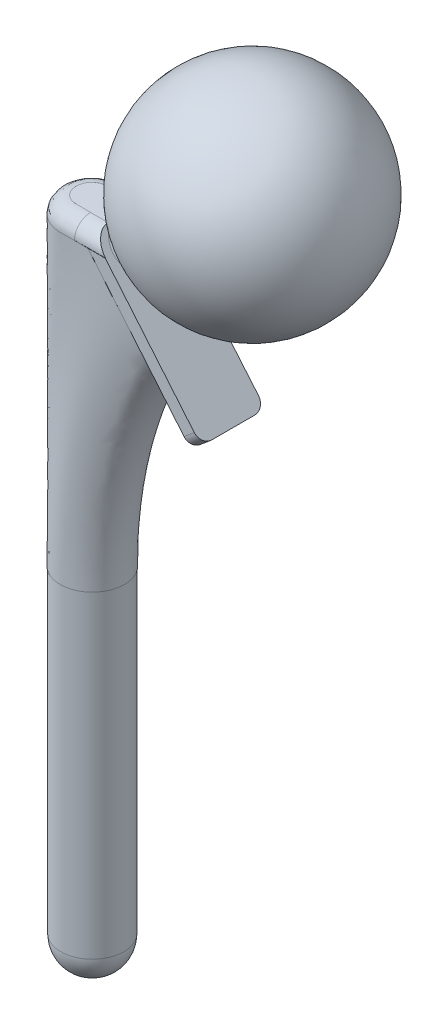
SolidWorks part; units mm, degrees
ref_plane "Front Plane" through (0, 0, 0) normal (0, 0, 1) x (1, 0, 0)
ref_plane "Top Plane" through (0, 0, 0) normal (0, 1, 0) x (1, 0, 0)
ref_plane "Right Plane" through (0, 0, 0) normal (1, 0, 0) x (0, 0, -1)
sketch "Sketch1" plane through (0, 0, 0) normal (0, 0, 1) x (1, 0, 0)
  line L0 (0, 0) -> (0, -7.493) construction
  line L1 (7.493, 0) -> (7.493, 75.565)
  line L2 (7.493, 75.565) -> (0, 75.565)
  line L3 (0, 75.565) -> (0, 0) construction
  line L4 (0, -7.493) -> (0, 75.565)
  arc A0 (7.493, 0) -> (0, -7.493) centre (0, 0) cw
  dimension "D1" = 7.493
  dimension "D2" = 75.565
revolve "Revolve1" add sketch "Sketch1" angle 360 about L4
sketch "Sketch2" plane through (0, 75.565, 0) normal (0, 1, 0) x (1, 0, 0)
  circle A0 centre (0, 0) radius 7.62
  dimension "D1" = 15.24
ref_plane "Plane1" through (0, 151.765, 0) normal (0, 1, 0) x (-1, 0, 0)
sketch "Sketch3" plane through (0, 151.765, 0) normal (0, 1, 0) x (-1, 0, 0)
  line L0 (0, 7.62) -> (-31.75, 7.62)
  line L1 (-31.75, -7.62) -> (0, -7.62)
  arc A0 (0, -7.62) -> (0, 7.62) centre (0, 0) ccw
  circle A1 centre (0, 0) radius 7.62 construction
  arc A2 (-31.75, 7.62) -> (-31.75, -7.62) centre (-31.75, 0) ccw
  dimension "D1" = 15.24
  dimension "D2" = 31.75
sketch "Sketch4" plane through (0, 0, 0) normal (0, 0, 1) x (1, 0, 0)
  line L0 (7.62, 75.565) -> (-7.62, 75.565) construction
  line L1 (39.37, 151.765) -> (31.75, 151.765) construction
  line L2 (7.62, 75.565) -> (7.62, 66.6693) construction
  line L3 (0, 0) -> (0, 75.565) construction
  line L4 (0, 75.565) -> (0, 151.765) construction
  line L5 (0, 151.765) -> (-7.62, 151.765) construction
  line L6 (31.75, 151.765) -> (0, 151.765) construction
  arc A0 (7.62, 75.565) -> (39.37, 151.765) centre (114.935, 75.565) cw
  dimension "D1" = 7.62
  dimension "D2" = 39.37
sketch "Sketch5" plane through (0, 0, 0) normal (0, 0, 1) x (1, 0, 0)
  line L0 (-7.62, 75.565) -> (-7.62, 151.765)
  line L1 (7.62, 75.565) -> (-7.62, 75.565) construction
  line L2 (0, 151.765) -> (-7.62, 151.765) construction
  line L3 (0, 75.565) -> (0, 151.765) construction
  dimension "D1" = 7.62
loft "Loft2" add profiles "Sketch2", "Sketch3"
fillet "Fillet1" radius 3.81 4 edges
sketch "Sketch6" plane through (0, 0, 0) normal (0, 0, 1) x (1, 0, 0)
  line L0 (3.3213, 151.765) -> (22.0951, 129.3913)
  line L1 (30.6231, 151.765) -> (-3.81, 151.765) construction
  line L2 (0, 0) -> (0, 151.765) construction
  line L3 (3.3213, 151.765) -> (22.7788, 168.0918)
  line L4 (22.7788, 168.0918) -> (41.5526, 145.7181)
  line L5 (41.5526, 145.7181) -> (22.0951, 129.3913)
  spline S0 degree 3 poles (7.62, 75.565) (7.62, 101.3044) (16.8678, 126.0869) (33.5137, 145.473) knots 0 0 0 0 0.899465 0.899465 0.899465 0.899465 construction
  dimension "D1" = 3.3213
  dimension "D2" = 40
  dimension "D3" = 25.4
extrude "Extrude1" cut sketch "Sketch6" against normal mid plane 50.8
sketch "Sketch7" plane through (76.6787, 64.3411, 0) normal (0.766, 0.6428, 0) x (0, 0, -1)
  line L0 (7.5712, 109.1027) -> (7.6173, 73.546)
  line L1 (5.0773, 71.0027) -> (-5.0773, 71.0027)
  line L2 (-7.6173, 73.546) -> (-7.5712, 109.1027)
  line L3 (-3.7155, 114.1238) -> (3.7155, 114.1238)
  arc A0 (-7.6173, 73.546) -> (-5.0773, 71.0027) centre (-5.0773, 73.5427) ccw
  arc A1 (7.6173, 73.546) -> (5.0773, 71.0027) centre (5.0773, 73.5427) cw
  spline S0 degree 3 poles (7.6207, 57.8862) (7.6207, 58.2373) (7.6207, 58.9145) (7.6207, 59.8857) (7.6207, 60.7784) (7.6207, 61.5932) (7.6207, 62.3316) (7.6207, 62.9945) (7.6207, 63.583) (7.6206, 64.1014) (7.6206, 64.5723) (7.6206, 65.021) (7.6206, 65.4693) (7.6206, 65.9199) (7.6206, 66.3728) (7.6206, 66.828) (7.6206, 67.2854) (7.6206, 68.741) (7.6206, 71.162) (7.6205, 74.4744) (7.6205, 77.6933) (7.6204, 80.8086) (7.6204, 83.7975) (7.6203, 86.8608) (7.6203, 90.0427) (7.6202, 93.1551) (7.6202, 95.9921) (7.6202, 98.1251) (7.6201, 99.7733) (7.6201, 100.588) (7.6201, 100.9912) knots 0 0 0 0 0.020395 0.039344 0.056848 0.072911 0.087536 0.100724 0.112477 0.122799 0.13189 0.140881 0.149946 0.159086 0.168301 0.17759 0.186953 0.196391 0.26726 0.338129 0.408481 0.478834 0.548597 0.616333 0.698332 0.784595 0.857003 0.927193 0.963965 1 1 1 1 construction
  spline S1 degree 3 poles (-7.6201, 100.9912) (-7.6201, 100.7894) (-7.6201, 100.3875) (-7.6201, 99.7732) (-7.6201, 99.1472) (-7.6202, 97.9089) (-7.6202, 95.9919) (-7.6202, 93.1551) (-7.6203, 90.0427) (-7.6203, 86.8608) (-7.6204, 83.7975) (-7.6204, 80.8086) (-7.6205, 77.6933) (-7.6205, 74.4744) (-7.6206, 71.162) (-7.6206, 68.4918) (-7.6206, 66.5332) (-7.6206, 65.3256) (-7.6206, 64.0141) (-7.6207, 62.4164) (-7.6207, 60.346) (-7.6207, 58.7648) (-7.6207, 57.8862) knots 0 0 0 0 0.0181 0.036035 0.054271 0.072808 0.142998 0.215405 0.301668 0.383667 0.451404 0.521167 0.59152 0.661872 0.732741 0.80361 0.828612 0.853085 0.877202 0.90791 0.948827 1 1 1 1 construction
  spline S2 degree 3 poles (1999.5763, 235.4194) (-812.7878, -134.5565) (23.5956, 53.3136) (7.2551, 111.1066) (7.155, 111.3826) (6.9154, 111.9107) (6.7755, 112.1646) (6.4493, 112.6493) (6.2635, 112.878) (5.9555, 113.1861) (5.8476, 113.2835) (5.6201, 113.4665) (5.4997, 113.5526) (5.1277, 113.7852) (4.8642, 113.9083) (-15.2716, 120.0198) (-75.7177, -77.6137) (842.9139, -1696.8115) knots -25.331774 -25.331774 -25.331774 -25.331774 0.25 0.25 0.375 0.375 0.5 0.5 0.625 0.625 0.6875 0.6875 0.75 0.75 0.875 0.875 9.68281 9.68281 9.68281 9.68281 only from (7.5712, 109.1027) to (3.7155, 114.1238) construction
  spline S3 degree 3 poles (7.5712, 109.1027) (7.571, 109.689) (7.4935, 110.2635) (7.2551, 111.1066) (7.155, 111.3826) (6.9154, 111.9107) (6.7755, 112.1646) (6.4493, 112.6493) (6.2635, 112.878) (5.9555, 113.1861) (5.8476, 113.2835) (5.6201, 113.4665) (5.4997, 113.5526) (5.1277, 113.7852) (4.8642, 113.9083) (4.3007, 114.0793) (4.0107, 114.1238) (3.7155, 114.1238) knots 0 0 0 0 0.25 0.25 0.375 0.375 0.5 0.5 0.625 0.625 0.6875 0.6875 0.75 0.75 0.875 0.875 1 1 1 1
  spline S4 degree 3 poles (417.1437, -1840.7887) (71.7093, -74.4359) (15.1575, 119.9498) (-4.7174, 113.9531) (-4.856, 113.9003) (-5.1216, 113.7783) (-5.2496, 113.7088) (-5.6205, 113.4773) (-5.8512, 113.2902) (-6.2623, 112.8795) (-6.4456, 112.6541) (-6.7734, 112.1684) (-6.9146, 111.9123) (-7.154, 111.3849) (-7.2531, 111.1125) (-7.4125, 110.5509) (-7.4722, 110.2633) (-13.6014, 65.5367) (446.1785, -35.6798) (1956.1044, -264.8838) knots -8.694384 -8.694384 -8.694384 -8.694384 0.125 0.125 0.1875 0.1875 0.25 0.25 0.375 0.375 0.5 0.5 0.625 0.625 0.75 0.75 0.875 0.875 20.139552 20.139552 20.139552 20.139552 only from (-3.7155, 114.1238) to (-7.5712, 109.1027) construction
  spline S5 degree 3 poles (-3.7155, 114.1238) (-4.0107, 114.1238) (-4.2979, 114.0797) (-4.7174, 113.9531) (-4.856, 113.9003) (-5.1216, 113.7783) (-5.2496, 113.7088) (-5.6205, 113.4773) (-5.8512, 113.2902) (-6.2623, 112.8795) (-6.4456, 112.6541) (-6.7734, 112.1684) (-6.9146, 111.9123) (-7.154, 111.3849) (-7.2531, 111.1125) (-7.4125, 110.5509) (-7.4722, 110.2633) (-7.5512, 109.6866) (-7.5711, 109.3959) (-7.5712, 109.1027) knots 0 0 0 0 0.125 0.125 0.1875 0.1875 0.25 0.25 0.375 0.375 0.5 0.5 0.625 0.625 0.75 0.75 0.875 0.875 1 1 1 1
  point P12 (-7.6206, 71.0027)
  point P15 (7.6206, 71.0027)
  dimension "D1" = 2.54
  dimension "D2" = 38.1
extrude "Extrude2" add sketch "Sketch7" along normal blind 3.175
sketch "Sketch9" plane through (0, 0, 0) normal (1, 0, 0) x (0, 0, -1)
  line L1 (-7.5255, 147.955) -> (-7.5255, 154.305) construction
  line L2 (-7.5255, 154.305) -> (7.5255, 154.305)
  line L3 (7.5255, 154.305) -> (7.5255, 147.955) construction
  line L4 (0, 0) -> (0, 147.955) construction
  line L5 (0, 147.955) -> (0, 151.765) construction
  line L6 (3.7155, 151.765) -> (-3.7155, 151.765) construction
  line L7 (-3.7155, 151.765) -> (3.7155, 151.765)
  line L8 (-7.5255, 147.955) -> (-10.0655, 147.955)
  line L9 (-10.0655, 147.955) -> (-10.0655, 154.305)
  line L10 (-10.0655, 154.305) -> (-7.5255, 154.305)
  line L11 (7.5255, 154.305) -> (10.0655, 154.305)
  line L12 (10.0655, 154.305) -> (10.0655, 147.955)
  line L13 (10.0655, 147.955) -> (7.5255, 147.955)
  arc A0 (3.7155, 151.765) -> (7.5255, 147.955) centre (3.7155, 147.955) cw
  arc A1 (-3.7155, 151.765) -> (-7.5255, 147.955) centre (-3.7155, 147.955) ccw
  dimension "D1" = 6.35
  dimension "D2" = 3.81
  dimension "D3" = 3.81
  dimension "D4" = 2.54
  dimension "D5" = 2.54
extrude "Extrude4" cut sketch "Sketch9" along normal blind 25.4
sketch "Sketch10" plane through (0, 0, 0) normal (0, 0, 1) x (1, 0, 0)
  line L0 (-7.62, 147.955) -> (10.6629, 147.955) construction
  line L1 (10.6629, 147.955) -> (31.8364, 122.7214) construction
sketch "Sketch11" plane through (79.1109, 66.3819, 0) normal (0.766, 0.6428, 0) x (0, 0, -1)
  line L0 (0, 118.2381) -> (0, 106.4861) construction
  circle A0 centre (0, 106.4861) radius 4.445
  dimension "D1" = 8.89
extrude "Extrude5" add sketch "Sketch11" along normal blind 35.687
fillet "Fillet2" radius 1.27 1 edges at (13.5201, 144.5499, 0)
sketch "Sketch12" plane through (106.4487, 89.3211, 0) normal (0.766, 0.6428, 0) x (0, 0, -1)
  point P0 (0, 106.4861)
sketch "Sketch13" plane through (0, 0, 0) normal (0, 0, 1) x (1, 0, 0)
  line L0 (40.858, 167.4891) -> (35.1436, 174.2992) construction
  line L1 (38.0008, 195.8941) -> (38.0008, 145.8942)
  arc A0 (38.0008, 145.8942) -> (38.0008, 195.8941) centre (38.0008, 170.8942) ccw
  dimension "D1" = 49.9999
revolve "Revolve2" add sketch "Sketch13" angle 360 about L1
fillet "Fillet3" radius 6.35 1 edges at (16.2976, 158.4856, 0)
